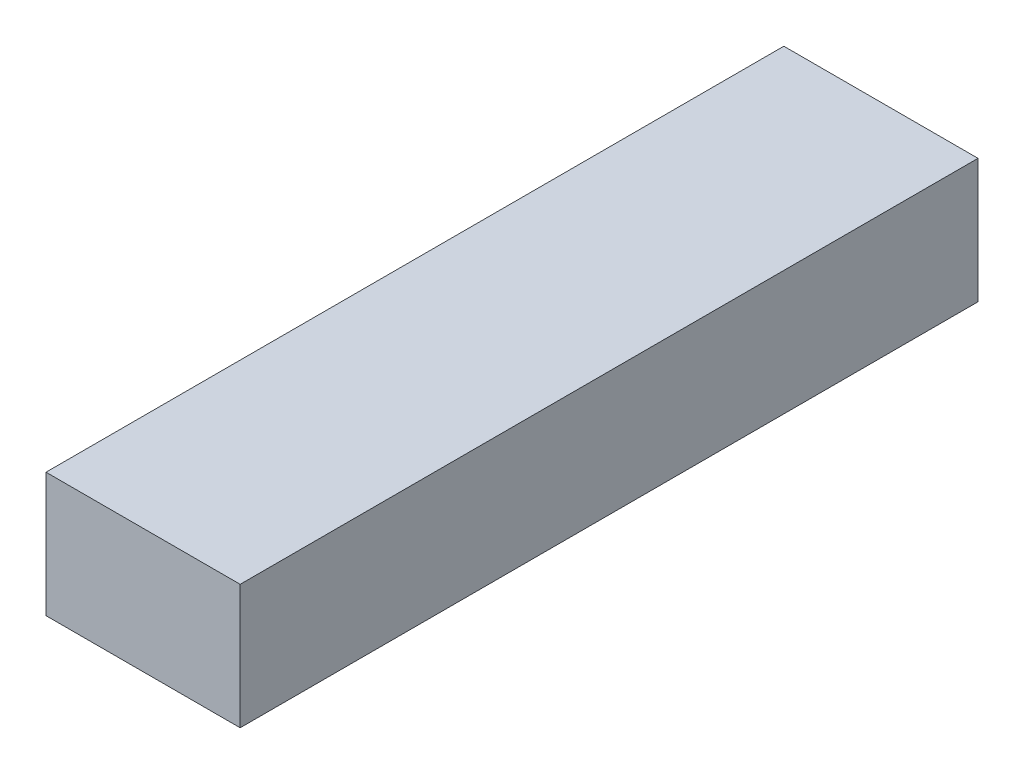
SolidWorks part; units mm, degrees
ref_plane "Alzado" through (0, 0, 0) normal (0, 0, 1) x (1, 0, 0)
ref_plane "Planta" through (0, 0, 0) normal (0, 1, 0) x (1, 0, 0)
ref_plane "Vista lateral" through (0, 0, 0) normal (1, 0, 0) x (0, 0, -1)
sketch "Croquis1" plane through (0, 0, 0) normal (0, 0, 1) x (1, 0, 0)
  line L0 (27.5, 17.5) -> (-27.5, -17.5) construction
  line L1 (-27.5, 17.5) -> (27.5, 17.5)
  line L2 (-27.5, 17.5) -> (-27.5, -17.5)
  line L3 (-27.5, -17.5) -> (27.5, -17.5)
  line L4 (27.5, 17.5) -> (27.5, -17.5)
extrude "Extruir1" add sketch "Croquis1" along normal mid plane 190
sketch "Croquis2" plane through (0, 0, 0) normal (0, 0, 1) x (1, 0, 0)
  line L0 (-25, 16) -> (-25, -16)
  line L1 (-25, -16) -> (25, -16)
  line L2 (25, -16) -> (25, 16)
  line L3 (25, 16) -> (-25, 16)
  line L4 (25, 16) -> (-25, -16) construction
  line L9 (-27.5, 17.5) -> (-27.5, -17.5)
  line L10 (-27.5, -17.5) -> (27.5, -17.5)
  line L11 (27.5, -17.5) -> (27.5, 17.5)
  line L12 (27.5, 17.5) -> (-27.5, 17.5)
  line L13 (-27.5, 17.5) -> (-27.5, -17.5)
  line L14 (-27.5, -17.5) -> (27.5, -17.5)
  line L15 (27.5, -17.5) -> (27.5, 17.5)
  line L16 (27.5, 17.5) -> (-27.5, 17.5)
  dimension "D1" = 0
  dimension "D2" = 50
  dimension "D3" = 32
extrude "Cepillado" cut sketch "Croquis2" against normal through all and the other way through all
